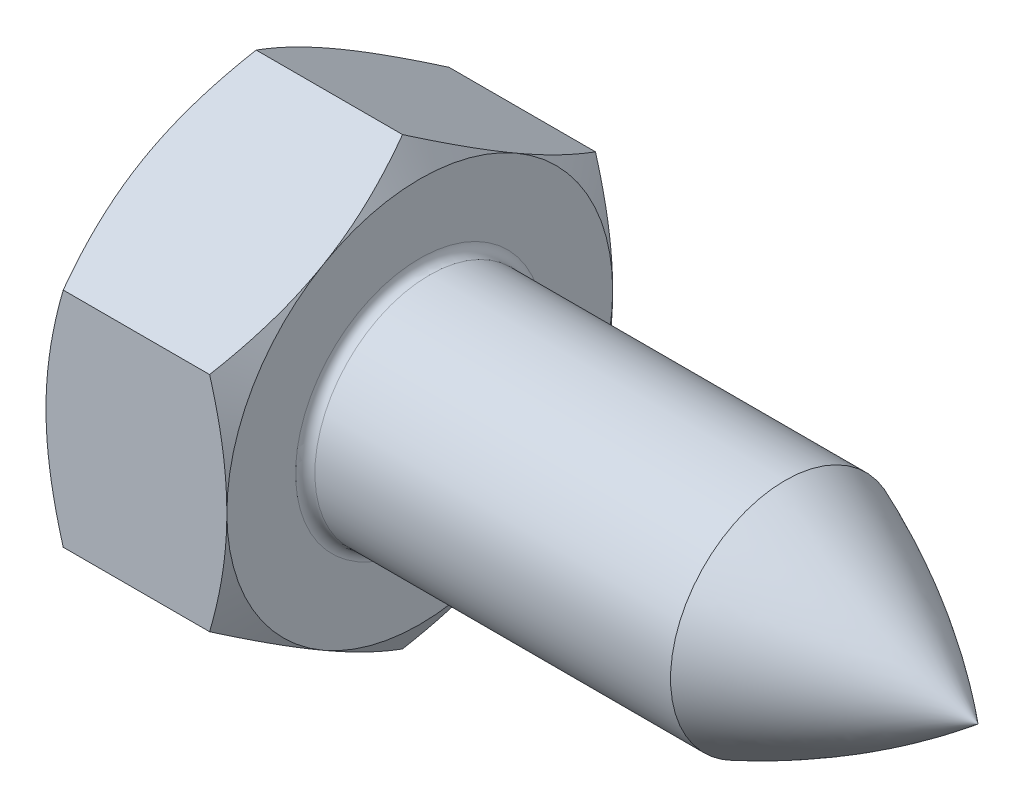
SolidWorks part; units mm, degrees
ref_plane "Front" through (0, 0, 0) normal (0, 0, 1) x (1, 0, 0)
ref_plane "Top" through (0, 0, 0) normal (0, 1, 0) x (1, 0, 0)
ref_plane "Right" through (0, 0, 0) normal (1, 0, 0) x (0, 0, -1)
sketch "Sketch2" plane through (0, 0, 0) normal (1, 0, 0) x (0, 0, -1)
  line L1 (0, 9.2376) -> (-8, 4.6188)
  line L2 (-8, 4.6188) -> (-8, -4.6188)
  line L3 (-8, -4.6188) -> (0, -9.2376)
  line L4 (0, -9.2376) -> (8, -4.6188)
  line L5 (8, -4.6188) -> (8, 4.6188)
  line L6 (8, 4.6188) -> (0, 9.2376)
  circle A0 centre (0, 0) radius 8 construction
  dimension "s" = 16
extrude "BaseHead" add sketch "Sketch2" along normal blind 7.5
sketch "Sketch1" plane through (0, 0, 0) normal (0, 0, 1) x (1, 0, 0)
  line L0 (-9.5445, 0) -> (41.9665, 0) construction
  line L1 (30.65, 0) -> (30.65, 4.75)
  line L2 (30.65, 4.75) -> (7.5, 4.75)
  line L3 (7.5, 4.75) -> (7.5, 0)
  line L4 (30.65, 0) -> (7.5, 0)
  line L5 (7.5, 4.6188) -> (7.5, -4.6188) construction
  line L6 (9.6, 14.495) -> (9.6, -5.1728) construction
  dimension "st" = 9.5
  dimension "l" = 23.15
  dimension "a" = 2.1
revolve "BaseBody" add sketch "Sketch1" angle 360 about L0
sketch "Sketch3" plane through (0, 0, 0) normal (0, 0, 1) x (1, 0, 0)
  line L0 (10.6638, 0) -> (-1.5125, 0) construction
  line L2 (0, 8) -> (0.7145, 9.2376)
  line L5 (0.7145, 9.2376) -> (0, 9.2376)
  line L6 (0, 9.2376) -> (0, 8)
  line L7 (3.75, 9.2376) -> (3.75, 3.7337) construction
  line L8 (7.5, 9.2376) -> (7.5, 8)
  line L9 (6.7855, 9.2376) -> (7.5, 9.2376)
  line L10 (7.5, 8) -> (6.7855, 9.2376)
  dimension "D1" = 16
  dimension "D2" = 30
revolve "Cut-Revolve7" cut sketch "Sketch3" angle 360 about L0
sketch "Sketch7" plane through (0, 0, 0) normal (0, 0, 1) x (1, 0, 0)
  line L0 (0, 0) -> (-8.2734, 0) construction
  line L1 (-0.1, 6.6667) -> (1.5, 6.6667)
  line L2 (-0.1, 6.6667) -> (-0.1, 0)
  line L3 (-0.1, 0) -> (1.5, 0)
  line L4 (1.5, 6.6667) -> (1.5, 0)
  line L5 (7.5, 0) -> (7.5, 6.9282) construction
  dimension "D1" = 0.1
  dimension "D3" = 13.3333
  dimension "K'" = 6
revolve "Cut-Revolve8" cut sketch "Sketch7" angle 360 about L0
sketch "Sketch4" plane through (1.5, -1.1147, 0.1688) normal (-1, 0, 0) x (0, 0, 1)
  line L0 (-9.754, 1.1147) -> (9.3086, 1.1147) construction
  line L1 (-0.1688, 11.4359) -> (-0.1688, -1.847) construction
  line L2 (0.5512, 4.7147) -> (-0.8888, 4.7147)
  line L3 (-0.8888, 4.7147) -> (-0.8888, 1.8347)
  line L4 (-0.8888, 1.8347) -> (-3.7688, 1.8347)
  line L5 (-3.7688, 1.8347) -> (-3.7688, 0.3947)
  line L6 (3.4312, 1.8347) -> (3.4312, 0.3947)
  line L7 (0.5512, 1.8347) -> (3.4312, 1.8347)
  line L8 (0.5512, 4.7147) -> (0.5512, 1.8347)
  line L9 (0.5512, -2.4853) -> (0.5512, 0.3947)
  line L10 (0.5512, 0.3947) -> (3.4312, 0.3947)
  line L11 (-0.8888, 0.3947) -> (-3.7688, 0.3947)
  line L12 (-0.8888, -2.4853) -> (-0.8888, 0.3947)
  line L13 (0.5512, -2.4853) -> (-0.8888, -2.4853)
  point P14 (-0.1688, 4.7147)
  point P17 (3.4312, 1.1147)
  point P18 (-3.7688, 1.1147)
  point P20 (-0.1688, -2.4853)
  dimension "D1" = 1.44
  dimension "m" = 7.2
sketch "Sketch9" plane through (7.5, 0, 0) normal (1, 0, 0) x (0, 0, -1)
  point P0 (0, 0)
loft "Cut-Loft1" cut profiles "Sketch9", "Sketch4"
fillet "Fillet1" radius 0.4 1 edges at (7.5, 0, 4.75)
sketch "Sketch5" plane through (0, 0, 0) normal (0, 0, 1) x (1, 0, 0)
  line L0 (31.9782, 0) -> (17.0112, 0) construction
  line L2 (26.45, -4.75) -> (28.55, -4.75)
  line L3 (28.55, -4.75) -> (30.65, -4.225)
  line L5 (30.65, -4.75) -> (30.65, 4.75) construction
  line L6 (26.45, -4.75) -> (26.45, -5.25)
  line L7 (26.45, -5.25) -> (30.65, -5.25)
  line L8 (30.65, -5.25) -> (30.65, -4.225)
  point P15 (28.55, -4.75)
  dimension "D1" = 9.5
  dimension "yf" = 4.2
  dimension "D2" = 2.1
  dimension "D3" = 0.525
  dimension "D4" = 0.5
revolve "Cut-Revolve1" cut sketch "Sketch5" angle 360 about L0
sketch "Sketch6" plane through (0, 0, 0) normal (0, 0, 1) x (1, 0, 0)
  line L0 (33.3907, 0) -> (10.0621, 0) construction
  line L2 (30.65, -4.75) -> (30.65, 4.75) construction
  line L3 (30.65, 0) -> (22.65, -4.75) construction
  line L6 (30.65, 0) -> (31.15, 0)
  line L7 (22.65, -4.75) -> (30.65, -4.75)
  line L8 (31.15, 0) -> (31.15, -4.75)
  line L9 (31.15, -4.75) -> (30.65, -4.75)
  arc A0 (30.65, 0) -> (22.65, -4.75) centre (10.4863, 24.8481) cw
  dimension "D1" = 32
  dimension "D2" = 0.5
  dimension "yc" = 8
  dimension "D3" = 9.5
revolve "Cut-Revolve6" cut sketch "Sketch6" angle 360 about L0
sketch "Sketch8" plane through (0, 0, 0) normal (0, 0, 1) x (1, 0, 0)
  line L0 (9.35, 5.25) -> (9.85, 5.25)
  line L1 (9.85, 5.25) -> (9.85, 4.75)
  line L2 (9.85, 4.75) -> (9.6, 4.317)
  line L3 (9.6, 4.317) -> (9.35, 4.75)
  line L4 (9.35, 4.75) -> (9.35, 5.25)
  line L5 (0, 0) -> (16.5709, 0) construction
  line L6 (-9.5445, 0) -> (41.9665, 0) construction
  line L7 (7.5, 0) -> (7.5, 6.9282) construction
  dimension "D1" = 9.5
  dimension "D2" = 0.5
  dimension "D3" = 2.1
revolve "Cut-Revolve10" [suppressed] cut sketch "Sketch8" angle 360 about L5
pattern_linear "LPattern10" [suppressed] count 35 spacing 0.6 along (1, 0, 0)
equation "\"D3@Sketch5\" = \"yf@Sketch5\" / 8"
equation "\"D2@ThreadCosmetic1\" = \"st@Sketch1\" - 1"
equation "\"D1@Sketch6\" = \"yc@Sketch6\" * 4"
equation "\"D3@Sketch6\" = \"st@Sketch1\""
equation "\"D2@Sketch5\" = \"yf@Sketch5\" / 2"
equation "\"D1@Sketch3\" = \"s@Sketch2\""
equation "\"D1@Sketch5\" = \"st@Sketch1\""
equation "\"D1@Sketch4\" = \"m@Sketch4\" / 5"
equation "\"D3@Sketch7\" = \"s@Sketch2\" * 5 / 6"
equation "\"D1@ThreadCosmetic1\" = \"l@Sketch1\"  - \"a@Sketch1\""
equation "\"D1@Sketch8\" = \"st@Sketch1\""
equation "\"D2@Sketch8\" =   ( \"st@Sketch1\" - \"D2@ThreadCosmetic1\" )  / 2"
equation "\"D3@Sketch8\" = \"a@Sketch1\""
equation "\"D3@LPattern10\" = \"D2@Sketch8\" * 1.2"
equation "\"D1@LPattern10\" = \"D1@ThreadCosmetic1\" / \"D3@LPattern10\""
